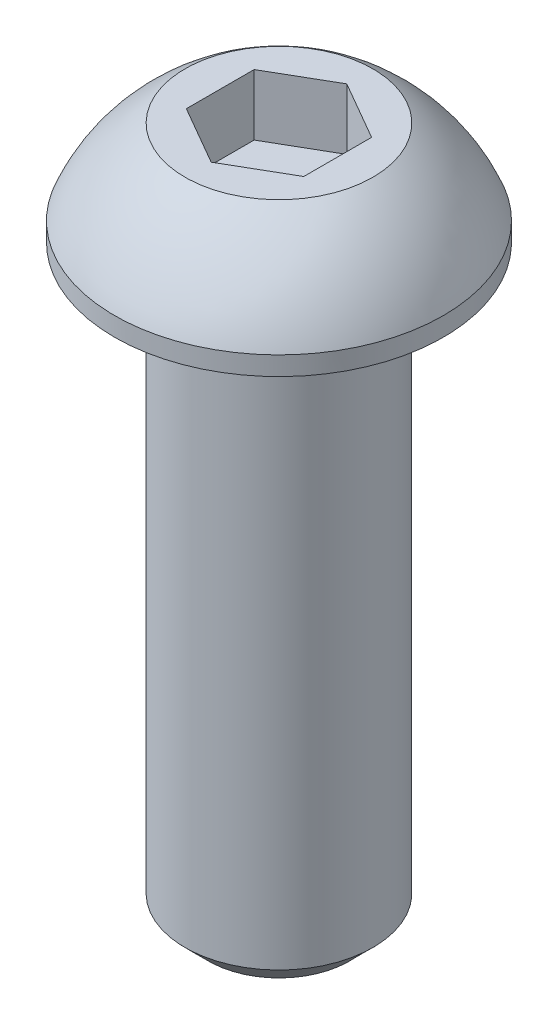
SolidWorks part; units mm, degrees
ref_plane "Face" through (0, 0, 0) normal (0, 0, 1) x (1, 0, 0)
ref_plane "Dessus" through (0, 0, 0) normal (0, 1, 0) x (1, 0, 0)
ref_plane "Droite" through (0, 0, 0) normal (1, 0, 0) x (0, 0, -1)
sketch "Esquisse1" plane through (0, 0, 0) normal (0, 0, 1) x (1, 0, 0)
  line L0 (0, 0) -> (7, 0)
  line L1 (7, 0) -> (7, 0.8)
  line L2 (4, 4.4) -> (0, 4.4)
  line L3 (0, 4.4) -> (0, 0)
  line L4 (0, 0) -> (0, 100) construction
  arc A0 (7, 0.8) -> (4, 4.4) centre (0, -1.9833) ccw
revolve "Base-Révolution" add sketch "Esquisse1" angle 360 about L4
sketch "Esquisse2" plane through (0, 0, 0) normal (0, 0, 1) x (1, 0, 0)
  line L0 (0, 0) -> (0, 100) construction
  line L1 (0, -25) -> (4, -25)
  line L2 (-7, 0) -> (7, 0) construction
  line L3 (4, -25) -> (4, 0)
  line L4 (4, 0) -> (0, 0)
  line L5 (0, 0) -> (0, -25)
  dimension "D1" = 8
  dimension "D2" = 25
revolve "Boss.-Révol.1" add sketch "Esquisse2" angle 360 about L0
ref_plane "Plan4" through (0, 4.4, 0) normal (0, 1, 0) x (-1, 0, 0)
sketch "Esquisse3" plane through (0, 4.4, 0) normal (0, 1, 0) x (-1, 0, 0)
  line L0 (2.5, 1.4434) -> (0, 2.8868)
  line L1 (0, 2.8868) -> (-2.5, 1.4434)
  line L2 (-2.5, 1.4434) -> (-2.5, -1.4434)
  line L3 (-2.5, -1.4434) -> (0, -2.8868)
  line L4 (0, -2.8868) -> (2.5, -1.4434)
  line L5 (2.5, -1.4434) -> (2.5, 1.4434)
extrude "Enlèv. mat.-Extru.1" cut sketch "Esquisse3" against normal blind 2.6
chamfer "Chanfrein1" distance 1 angle 45
